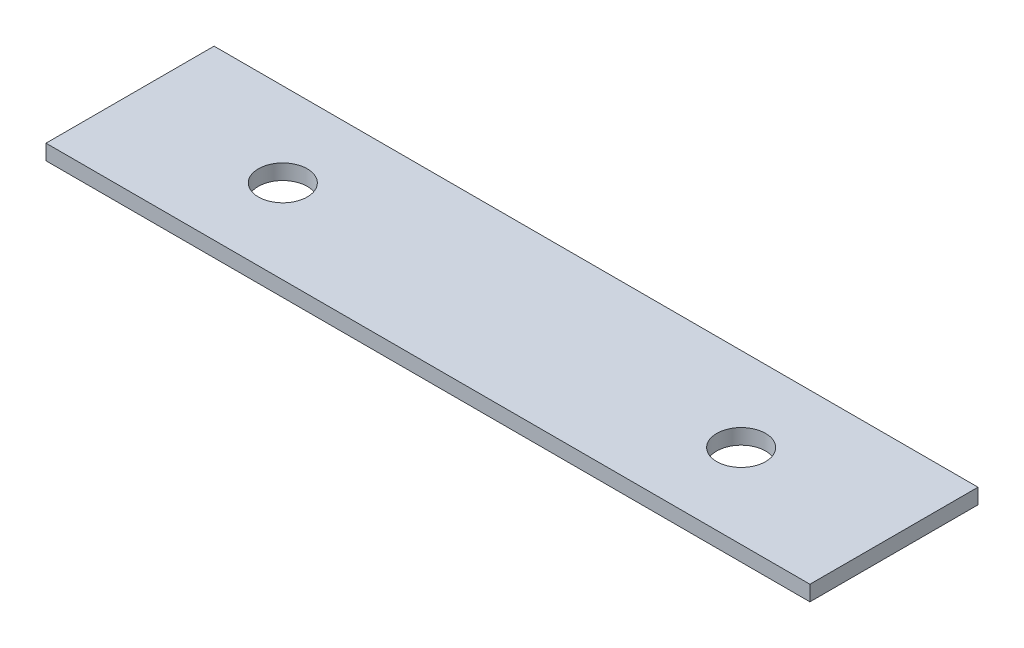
SolidWorks part; units mm, degrees
ref_plane "Front Plane" through (0, 0, 0) normal (0, 0, 1) x (1, 0, 0)
ref_plane "Top Plane" through (0, 0, 0) normal (0, 1, 0) x (1, 0, 0)
ref_plane "Right Plane" through (0, 0, 0) normal (1, 0, 0) x (0, 0, -1)
sketch "Sketch1" plane through (0, 0, 0) normal (0, 1, 0) x (1, 0, 0)
  line L0 (0, 0) -> (30, 0) construction
  line L1 (30, 0) -> (40, 0) construction
  line L3 (40, 5.5) -> (-10, 5.5)
  line L4 (40, 5.5) -> (40, -5.5)
  line L5 (40, -5.5) -> (-10, -5.5)
  line L6 (-10, 5.5) -> (-10, -5.5)
  circle A0 centre (0, 0) radius 1.6
  circle A1 centre (30, 0) radius 1.6
  dimension "D1" = 3.2
  dimension "D2" = 50
  dimension "D3" = 11
  dimension "D4" = 30
  dimension "D5" = 10
extrude "Extrude1" add sketch "Sketch1" along normal blind 1
